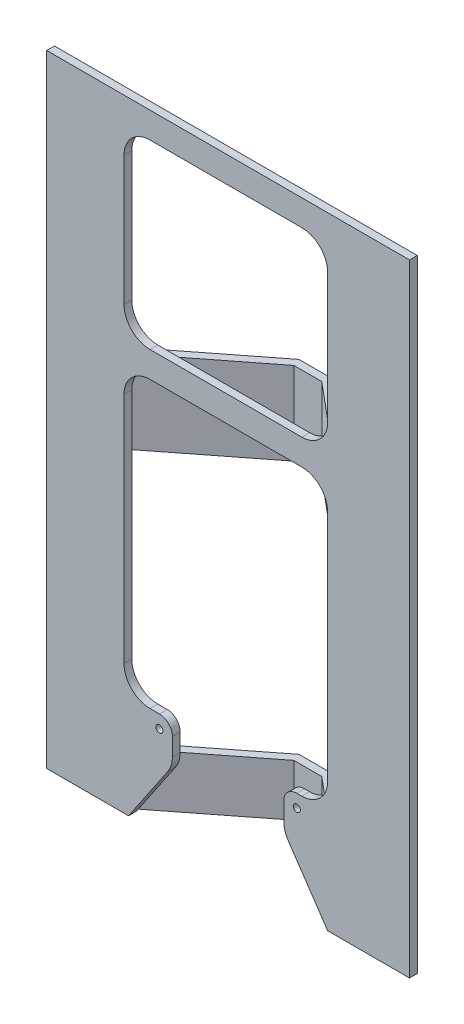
SolidWorks part; units mm, degrees
ref_plane "Front Plane" through (0, 0, 0) normal (0, 0, 1) x (1, 0, 0)
ref_plane "Top Plane" through (0, 0, 0) normal (0, 1, 0) x (1, 0, 0)
ref_plane "Right Plane" through (0, 0, 0) normal (1, 0, 0) x (0, 0, -1)
ref_plane "Plane1" through (0, -304.8, 0) normal (0, 1, 0) x (1, 0, 0)
sketch "Sketch1" plane through (0, 0, 0) normal (0, 0, 1) x (1, 0, 0)
  line L1 (88.9, -304.8) -> (-88.9, -304.8)
  line L2 (88.9, -304.8) -> (88.9, 0)
  line L3 (88.9, 0) -> (-88.9, 0)
  line L4 (-88.9, -304.8) -> (-88.9, 0)
  line L5 (88.9, -304.8) -> (-88.9, 0) construction
  line L6 (88.9, 0) -> (-88.9, -304.8) construction
  point P0 (0, -152.4)
  dimension "D1" = 304.8
  dimension "D2" = 177.8
extrude "Boss-Extrude1" add sketch "Sketch1" along normal blind 3.81
sketch "Sketch3" plane through (0, -304.8, 0) normal (0, -1, 0) x (1, 0, 0)
  line L0 (-62.0685, 3.81) -> (-55.88, 3.81)
  line L1 (-55.88, 3.81) -> (-6.4234, -34.8297)
  line L2 (-62.0685, 3.81) -> (-7.7353, -38.6397)
  line L3 (53.34, 3.81) -> (59.2673, 3.81)
  line L4 (59.2673, 3.81) -> (8.6777, -38.6397)
  line L5 (53.34, 3.81) -> (7.291, -34.8297)
  line L6 (0, 0) -> (0, -45.9874) construction
  line L7 (-88.9, 3.81) -> (88.9, 3.81) construction
  line L9 (-6.4234, -34.8297) -> (7.291, -34.8297)
  line L10 (-7.7353, -38.6397) -> (8.6777, -38.6397)
  dimension "D4" = 53.34
  dimension "D1" = 3.81
  dimension "D2" = 40
  dimension "D3" = 38
  dimension "D5" = 55.88
  dimension "D6" = 3.81
  dimension "D7" = 3.81
  dimension "D8" = 66.04
extrude "Boss-Extrude3" add sketch "Sketch3" against normal blind 25.4
ref_plane "Plane2" through (0, -111.76, 0) normal (0, 1, 0) x (1, 0, 0)
sketch "Sketch4" plane through (0, -111.76, 0) normal (0, 1, 0) x (1, 0, 0)
  line L16 (48.7994, 0) -> (54.7267, 0)
  line L17 (54.7267, 0) -> (8.6777, 38.6397)
  line L18 (8.6777, 38.6397) -> (-7.7353, 38.6397)
  line L19 (-7.7353, 38.6397) -> (-57.1919, 0)
  line L20 (-57.1919, 0) -> (-51.0034, 0)
  line L21 (-51.0034, 0) -> (-6.4234, 34.8297)
  line L22 (-6.4234, 34.8297) -> (7.291, 34.8297)
  line L23 (7.291, 34.8297) -> (48.7994, 0)
  line L24 (48.7994, 0) -> (54.7267, 0)
  line L25 (54.7267, 0) -> (8.6777, 38.6397)
  line L26 (8.6777, 38.6397) -> (-7.7353, 38.6397)
  line L27 (-7.7353, 38.6397) -> (-57.1919, 0)
  line L28 (-57.1919, 0) -> (-51.0034, 0)
  line L29 (-51.0034, 0) -> (-6.4234, 34.8297)
  line L30 (-6.4234, 34.8297) -> (7.291, 34.8297)
  line L31 (7.291, 34.8297) -> (48.7994, 0)
  dimension "D1" = 0
extrude "Boss-Extrude4" add sketch "Sketch4" against normal blind 40.64
ref_plane "Plane3" through (0, -270.51, 0) normal (0, 1, 0) x (1, 0, 0)
hole_wizard "#8-32 Tapped Hole1" positions "Sketch16" profile "Sketch15" tap size "#8-32" standard "ANSI Inch"
sketch "Sketch16" plane through (0, 0, 3.81) normal (0, 0, 1) x (1, 0, 0)
  circle A0 centre (-33.655, -260.35) radius 2.4574 construction
  circle A1 centre (33.655, -260.35) radius 2.4574 construction
  point P0 (-33.655, -260.35)
  point P6 (33.655, -260.35)
sketch "Sketch15" plane through (-33.655, -260.35, 3.81) normal (1, 0, 0) x (0, -1, 0)
  line L0 (0, 0) -> (0, 42.4497)
  line L1 (0, 42.4497) -> (1.7272, 42.4497)
  line L2 (1.7272, 42.4497) -> (1.7272, 0)
  line L5 (1.7272, 0) -> (0, 0)
  line L11 (0, -6.35) -> (0, 107.95) construction
  dimension "Thru Tap Drill Dia." = 3.4544
  dimension "Thru Tap Drill Depth" = 42.4497
sketch "Sketch12" plane through (0, 0, 0) normal (0, 0, -1) x (-1, 0, 0)
  line L0 (-27.305, -260.35) -> (-27.305, -269.1554)
  line L1 (-36.0994, -12.7) -> (38.3034, -12.7)
  line L2 (51.0034, -127) -> (51.0034, -241.3)
  line L3 (38.3034, -101.6) -> (-36.0994, -101.6)
  line L4 (-48.7994, -88.9) -> (-48.7994, -25.4)
  line L5 (-48.7994, -304.8) -> (-29.4883, -276.2751)
  line L6 (27.305, -260.35) -> (27.305, -269.1554)
  line L7 (51.0034, -25.4) -> (51.0034, -88.9)
  line L8 (38.3034, -254) -> (33.655, -254)
  line L9 (-48.7994, -241.3) -> (-48.7994, -127)
  line L10 (0, 0) -> (0, -322.6515) construction
  line L11 (48.7994, -304.8) -> (29.4883, -276.2751)
  line L16 (38.3034, -114.3) -> (-36.0994, -114.3)
  line L18 (88.9, -304.8) -> (-88.9, -304.8) construction
  line L20 (48.7994, -304.8) -> (-48.7994, -304.8)
  line L22 (-33.655, -254) -> (-36.0994, -254)
  line L23 (-88.9, 0) -> (88.9, 0) construction
  line L24 (-48.7994, -152.4) -> (-48.7994, -111.76) construction
  line L25 (51.0034, -152.4) -> (51.0034, -111.76) construction
  circle A2 centre (-33.655, -260.35) radius 1.7272 construction
  arc A3 (-33.655, -254) -> (-27.305, -260.35) centre (-33.655, -260.35) cw
  arc A4 (33.655, -254) -> (27.305, -260.35) centre (33.655, -260.35) ccw
  arc A6 (51.0034, -127) -> (38.3034, -114.3) centre (38.3034, -127) ccw
  arc A7 (-36.0994, -114.3) -> (-48.7994, -127) centre (-36.0994, -127) ccw
  arc A8 (38.3034, -12.7) -> (51.0034, -25.4) centre (38.3034, -25.4) cw
  arc A9 (-48.7994, -25.4) -> (-36.0994, -12.7) centre (-36.0994, -25.4) cw
  arc A10 (-36.0994, -101.6) -> (-48.7994, -88.9) centre (-36.0994, -88.9) cw
  arc A11 (38.3034, -101.6) -> (51.0034, -88.9) centre (38.3034, -88.9) ccw
  arc A12 (51.0034, -241.3) -> (38.3034, -254) centre (38.3034, -241.3) cw
  arc A13 (-36.0994, -254) -> (-48.7994, -241.3) centre (-36.0994, -241.3) cw
  arc A14 (27.305, -269.1554) -> (29.4883, -276.2751) centre (40.005, -269.1554) ccw
  arc A15 (-27.305, -269.1554) -> (-29.4883, -276.2751) centre (-40.005, -269.1554) cw
  point P39 (-48.7994, -12.7)
  point P43 (-48.7994, -101.6)
  point P52 (27.305, -273.05)
  point P55 (-27.305, -273.05)
  dimension "D4" = 12.7
  dimension "D3" = 6.35
  dimension "D7" = 12.7
  dimension "D1" = 12.7
  dimension "D2" = 88.9
  dimension "D5" = 12.7
  dimension "D6" = 12.7
extrude "Cut-Extrude2" cut sketch "Sketch12" against normal up to next
